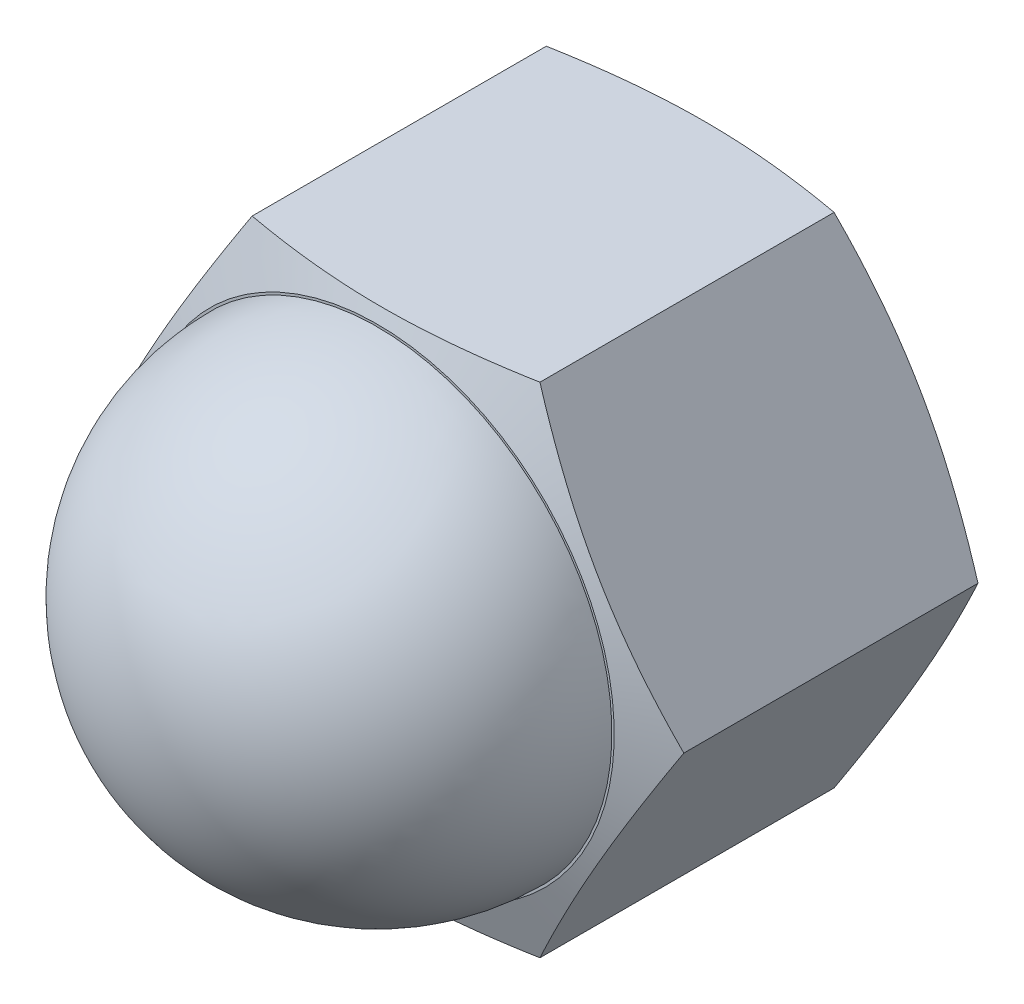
SolidWorks part; units mm, degrees
ref_plane "Front" through (0, 0, 0) normal (0, 0, 1) x (1, 0, 0)
ref_plane "Top" through (0, 0, 0) normal (0, 1, 0) x (1, 0, 0)
ref_plane "Right" through (0, 0, 0) normal (1, 0, 0) x (0, 0, -1)
sketch "Sketch1" plane through (0, 0, 0) normal (0, 0, 1) x (1, 0, 0)
  line L1 (5.6465, 0) -> (2.8232, 4.89)
  line L2 (2.8232, 4.89) -> (-2.8232, 4.89)
  line L3 (-2.8232, 4.89) -> (-5.6465, 0)
  line L4 (-5.6465, 0) -> (-2.8232, -4.89)
  line L5 (-2.8232, -4.89) -> (2.8232, -4.89)
  line L6 (2.8232, -4.89) -> (5.6465, 0)
  circle A0 centre (0, 0) radius 4.89 construction
  circle A1 centre (0, 0) radius 2.5
  dimension "d" = 5
  dimension "s" = 9.78
extrude "BaseNut" add sketch "Sketch1" against normal blind 6.5
sketch "Sketch2" plane through (0, 0, 0) normal (0, 1, 0) x (1, 0, 0)
  line L0 (-4.6455, 6.5) -> (-5.6465, 6.5)
  line L2 (-5.6465, 6.5) -> (-5.6465, 6.1357)
  line L4 (-5.6465, 6.1357) -> (-4.6455, 6.5)
  line L5 (0, 11.5694) -> (0, -9.1399) construction
  line L7 (-7.1748, 3.25) -> (8.0192, 3.25) construction
  line L8 (-5.6465, 0.3643) -> (-4.6455, 0)
  line L9 (-5.6465, 0) -> (-5.6465, 0.3643)
  line L10 (-4.6455, 0) -> (-5.6465, 0)
  line L11 (-2.8232, 0) -> (-5.6465, 0) construction
  dimension "D1" = 9.291
  dimension "Angle" = 20
  dimension "h1" = 3.25
revolve "DoubleChamfer" cut sketch "Sketch2" angle 360 about L5
sketch "Sketch3" plane through (-4.6, 0, -7.9176) normal (0, 1, 0) x (-1, 0, 0)
  line L2 (-4.6, 6.4176) -> (-8.9486, 6.4176)
  line L3 (-4.6, 5.0684) -> (-4.6, 6.4176) construction
  line L4 (-7.1, 1.4176) -> (-2.1, 1.4176) construction
  line L8 (-4.6, 12.5176) -> (-4.6, 6.4176)
  line L11 (-9.2455, 1.4176) -> (0.0455, 1.4176) construction
  arc A0 (-4.6, 12.5176) -> (-8.9486, 6.4176) centre (-4.6, 7.9176) ccw
  dimension "R" = 4.6
  dimension "h" = 6.5
  dimension "b" = 5
revolve "Crown" add sketch "Sketch3" angle 360 about L3
chamfer "EndChamfer" distance 0.65 angle 30 1 edges at (2.5, 0, -6.5)
sketch "Sketch4" plane through (0, 0, 0) normal (0, 1, 0) x (1, 0, 0)
  line L0 (0, 7.6611) -> (0, -9.4764) construction
  line L1 (2, 6.1) -> (2, 5.6)
  line L2 (2, 5.6) -> (2.5, 5.6)
  line L3 (2.5, 5.6) -> (2.933, 5.85)
  line L4 (2.933, 5.85) -> (2.5, 6.1)
  line L5 (2, 6.1) -> (2.5, 6.1)
  line L6 (-2.5, 5.85) -> (2.5, 5.85) construction
  dimension "D1" = 5
  dimension "D2" = 0.5
revolve "Cut-Revolve10" [suppressed] cut sketch "Sketch4" angle 360 about L0
pattern_linear "LPattern10" [suppressed] count 11 spacing 0.6 along (0, 0, 1)
equation "\"D1@Sketch2\" = 0.95 * \"s@Sketch1\""
equation "\"h1@Sketch2\" = \"h@Sketch3\" / 2"
equation "\"h@BaseNut\" = \"h@Sketch3\""
equation "\"D1@Sketch4\" = \"d@Sketch1\""
equation "\"D2@Sketch4\" =  ( \"D2@ThreadCosmetic1\" - \"d@Sketch1\" )  / 2"
equation "\"D3@LPattern10\" = \"D2@Sketch4\" * 1.2"
equation "\"D1@LPattern10\" = \"h@BaseNut\" / \"D3@LPattern10\""
